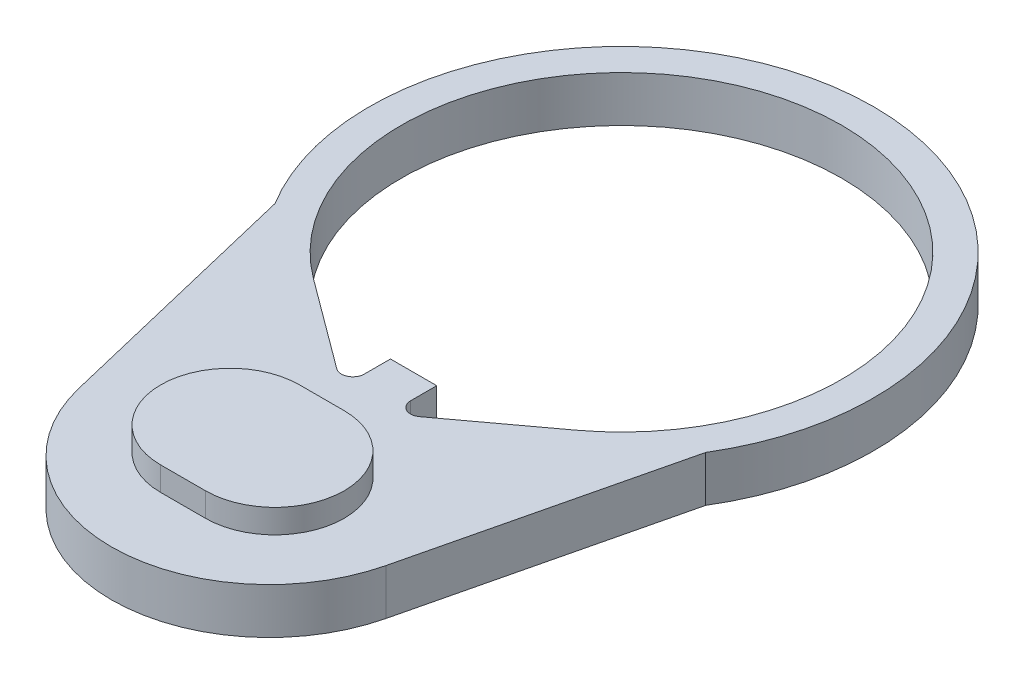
SolidWorks part; units mm, degrees
ref_plane "front" through (0, 0, 0) normal (0, 0, 1) x (1, 0, 0)
ref_plane "top" through (0, 0, 0) normal (0, 1, 0) x (1, 0, 0)
ref_plane "side" through (0, 0, 0) normal (1, 0, 0) x (0, 0, -1)
sketch "Sketch1" plane through (0, 0, 0) normal (0, 1, 0) x (1, 0, 0)
  line L0 (14.7896, -9.0043) -> (10.5374, -26.716)
  line L1 (-14.7896, -9.0043) -> (-10.5374, -26.716)
  line L2 (-2.8433, -16.7011) -> (-8.9917, -12.1515)
  line L3 (2.8433, -16.7011) -> (8.9917, -12.1515)
  line L4 (0, 0) -> (0, -24.1861) construction
  line L6 (0, -50) -> (0, 50) construction
  line L7 (-1.5875, -14.2712) -> (-1.5875, -16.0682)
  line L8 (1.5875, -14.2712) -> (1.5875, -16.0682)
  line L9 (-1.5875, -14.2712) -> (1.5875, -14.2712)
  line L10 (1.5875, 0) -> (1.5875, -24.1861) construction
  line L11 (-1.5875, 0) -> (-1.5875, -24.1861) construction
  arc A0 (8.9917, -12.1515) -> (-8.9917, -12.1515) centre (0, 0) ccw
  arc A1 (14.7896, -9.0043) -> (-14.7896, -9.0043) centre (0, 0) ccw
  arc A2 (-10.5374, -26.716) -> (10.5374, -26.716) centre (0, -24.1861) ccw
  arc A3 (-1.5875, -16.0682) -> (-2.8433, -16.7011) centre (-2.3749, -16.0682) cw
  arc A4 (1.5875, -16.0682) -> (2.8433, -16.7011) centre (2.3749, -16.0682) ccw
  dimension "D5" = 30.2331
  dimension "D6" = 34.6301
  dimension "D7" = 21.6737
  dimension "D8" = 24.1861
  dimension "D10" = 0.7874
  dimension "D1" = 13.5
  dimension "D2" = 1.5875
  dimension "D3" = 53.5
  dimension "D4" = 1.5875
  dimension "D9" = 20.7518
  dimension "D11" = 53.5
extrude "Boss-Extrude1" add sketch "Sketch1" along normal blind 3.1496
sketch "Sketch2" plane through (0, 3.1496, 0) normal (0, 1, 0) x (1, 0, 0)
  line L0 (-1.5367, -25.3329) -> (1.5367, -25.3329) construction
  line L2 (-1.5367, -20.5704) -> (1.5367, -20.5704)
  line L3 (-1.5367, -30.0954) -> (1.5367, -30.0954)
  line L4 (0, -50) -> (0, 50) construction
  arc A0 (-1.5367, -20.5704) -> (-1.5367, -30.0954) centre (-1.5367, -25.3329) ccw
  arc A1 (1.5367, -30.0954) -> (1.5367, -20.5704) centre (1.5367, -25.3329) ccw
  arc A4 (-10.5374, -26.716) -> (10.5374, -26.716) centre (0, -24.1861) ccw construction
  circle A5 centre (0, -25.3329) radius 6.2992 construction
  point P4 (0, -25.3329)
  dimension "D2" = 12.5984
  dimension "D4" = 12.5984
  dimension "D1" = 9.525
  dimension "D3" = 4.9276
extrude "Boss-Extrude2" add sketch "Sketch2" along normal offset from surface (1.6383 mm away) 4.7879
sketch "Sketch3" plane through (0, 0, 0) normal (0, -1, 0) x (1, 0, 0)
  line L0 (-1.5367, 25.3329) -> (1.5367, 25.3329) construction
  line L1 (-1.5367, 30.2224) -> (1.5367, 30.2224)
  line L2 (-1.5367, 20.5704) -> (1.5367, 20.5704)
  line L3 (1.5367, 30.0954) -> (-1.5367, 30.0954)
  line L4 (-1.5367, 20.5704) -> (1.5367, 20.5704) construction
  line L5 (1.5367, 30.0954) -> (-1.5367, 30.0954) construction
  line L6 (-1.5367, 20.4434) -> (1.5367, 20.4434)
  arc A0 (-1.5367, 30.2224) -> (-1.5367, 20.4434) centre (-1.5367, 25.3329) ccw
  arc A1 (1.5367, 20.4434) -> (1.5367, 30.2224) centre (1.5367, 25.3329) ccw
  arc A2 (1.5367, 20.5704) -> (1.5367, 30.0954) centre (1.5367, 25.3329) ccw
  arc A3 (-1.5367, 30.0954) -> (-1.5367, 20.5704) centre (-1.5367, 25.3329) ccw
  arc A4 (1.5367, 20.5704) -> (1.5367, 30.0954) centre (1.5367, 25.3329) ccw construction
  arc A5 (-1.5367, 30.0954) -> (-1.5367, 20.5704) centre (-1.5367, 25.3329) ccw construction
  point P2 (0, 25.3329)
  dimension "D2" = 9.779
  dimension "D1" = 0
extrude "Cut-Extrude1" cut sketch "Sketch3" against normal blind 1.6002
